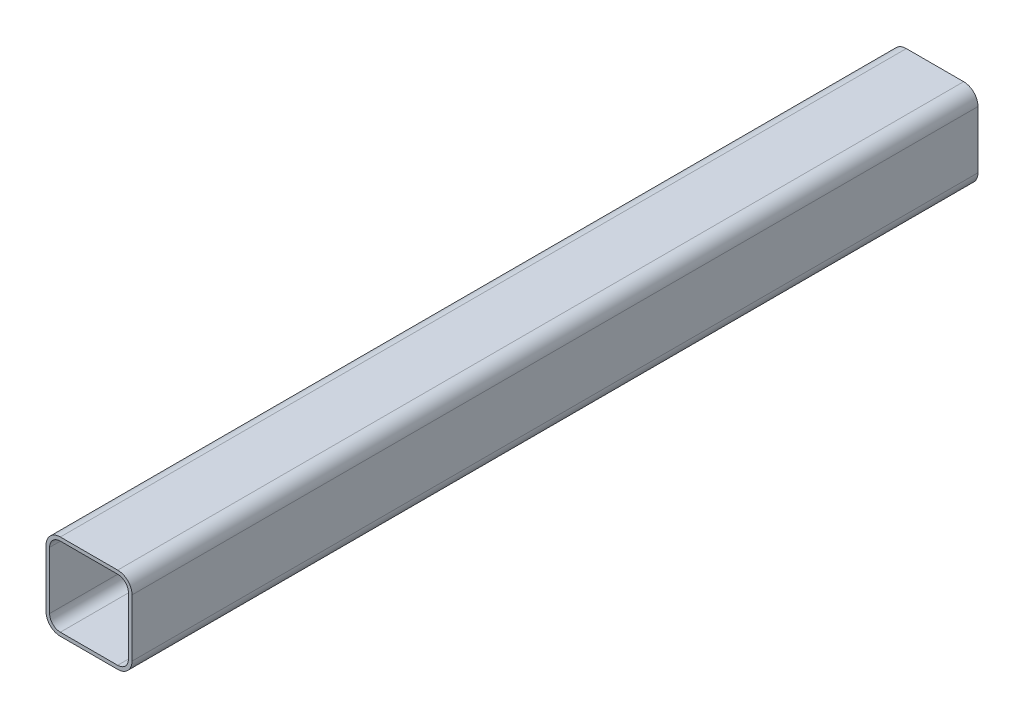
SolidWorks part; units mm, degrees
ref_plane "Front" through (0, 0, 0) normal (0, 0, 1) x (1, 0, 0)
ref_plane "Top" through (0, 0, 0) normal (0, 1, 0) x (1, 0, 0)
ref_plane "Right" through (0, 0, 0) normal (1, 0, 0) x (0, 0, -1)
sketch "Sketch1" plane through (0, 0, 0) normal (0, 0, 1) x (1, 0, 0)
  line L0 (-25.4, 38.1) -> (25.4, 38.1)
  line L1 (-38.1, 25.4) -> (-38.1, -25.4)
  line L2 (25.4, -38.1) -> (-25.4, -38.1)
  line L3 (38.1, -25.4) -> (38.1, 25.4)
  line L4 (0, 38.1) -> (0, -38.1) construction
  arc A0 (38.1, 25.4) -> (25.4, 38.1) centre (25.4, 25.4) ccw
  arc A1 (38.1, -25.4) -> (25.4, -38.1) centre (25.4, -25.4) cw
  arc A2 (-25.4, -38.1) -> (-38.1, -25.4) centre (-25.4, -25.4) cw
  arc A3 (-38.1, 25.4) -> (-25.4, 38.1) centre (-25.4, 25.4) cw
  dimension "D1" = 12.7
  dimension "D2" = 76.2
  dimension "D3" = 76.2
extrude "Base-Extrude-Thin" add sketch "Sketch1" along normal blind 749.3 thin
